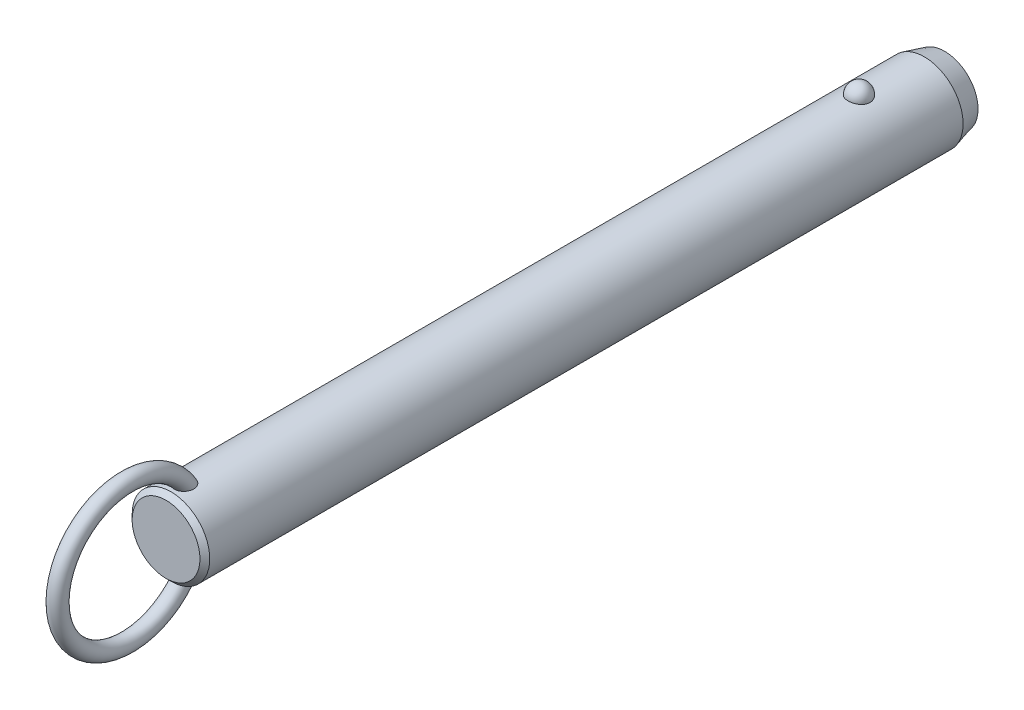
SolidWorks part; units mm, degrees
ref_plane "Front Plane" through (0, 0, 0) normal (0, 0, 1) x (1, 0, 0)
ref_plane "Top Plane" through (0, 0, 0) normal (0, 1, 0) x (1, 0, 0)
ref_plane "Right Plane" through (0, 0, 0) normal (1, 0, 0) x (0, 0, -1)
sketch "Sketch2" plane through (0, 0, 0) normal (0, 0, 1) x (1, 0, 0)
  circle A0 centre (0, 0) radius 9.5
  point P3 (0, 9.5)
  dimension "D1" = 19
extrude "Boss-Extrude1" add sketch "Sketch2" along normal blind 157.5
sketch "Sketch3" plane through (0, 0, 0) normal (0, 0, -1) x (-1, 0, 0)
  circle A0 centre (0, 0) radius 9.5
  dimension "D1" = 19
extrude "Boss-Extrude2" add sketch "Sketch3" along normal blind 23.7
chamfer "Chamfer1" distance 5 angle 15 1 edges at (-9.5, 0, -23.7)
sketch "Sketch12" plane through (0, 0, 0) normal (1, 0, 0) x (0, 0, -1)
  line L0 (-157.5, 9.5) -> (-157.5, -9.5) construction
  point P0 (-157.5, 0)
sketch "Sketch13" plane through (0, 0, 0) normal (1, 0, 0) x (0, 0, -1)
  circle A0 centre (-176.55, 0) radius 19.05
  point P2 (-157.5, 0)
  dimension "D1" = 38.1
sketch "Sketch14" plane through (0, 0, 0) normal (0, 1, 0) x (1, 0, 0)
  circle A0 centre (0, -159.5) radius 2
  point P2 (0, -157.5)
  dimension "D1" = 4
sweep "Sweep1" add profiles "Sketch14" path "Sketch13"
sketch "Sketch15" plane through (0, 0, 157.5) normal (0, 0, 1) x (1, 0, 0)
  circle A0 centre (0, 0) radius 9.5
  dimension "D1" = 19
extrude "Boss-Extrude3" add sketch "Sketch15" along normal blind 9.52
chamfer "Chamfer2" distance 1.2 angle 45 1 edges at (9.5, 0, 167.02)
sketch "Sketch18" plane through (0, 0, 0) normal (1, 0, 0) x (0, 0, -1)
  line L0 (18.7, 9.5) -> (-160.0378, 9.5) construction
  line L1 (2.7, 12.2) -> (2.7, 6.8)
  line L2 (-160.0378, -9.5) -> (18.7, -9.5) construction
  arc A0 (2.7, 12.2) -> (2.7, 6.8) centre (2.7, 9.5) ccw
  point P4 (0, 9.5)
  dimension "D1" = 21.7
revolve "Revolve1" add sketch "Sketch18" angle 360 about L1
